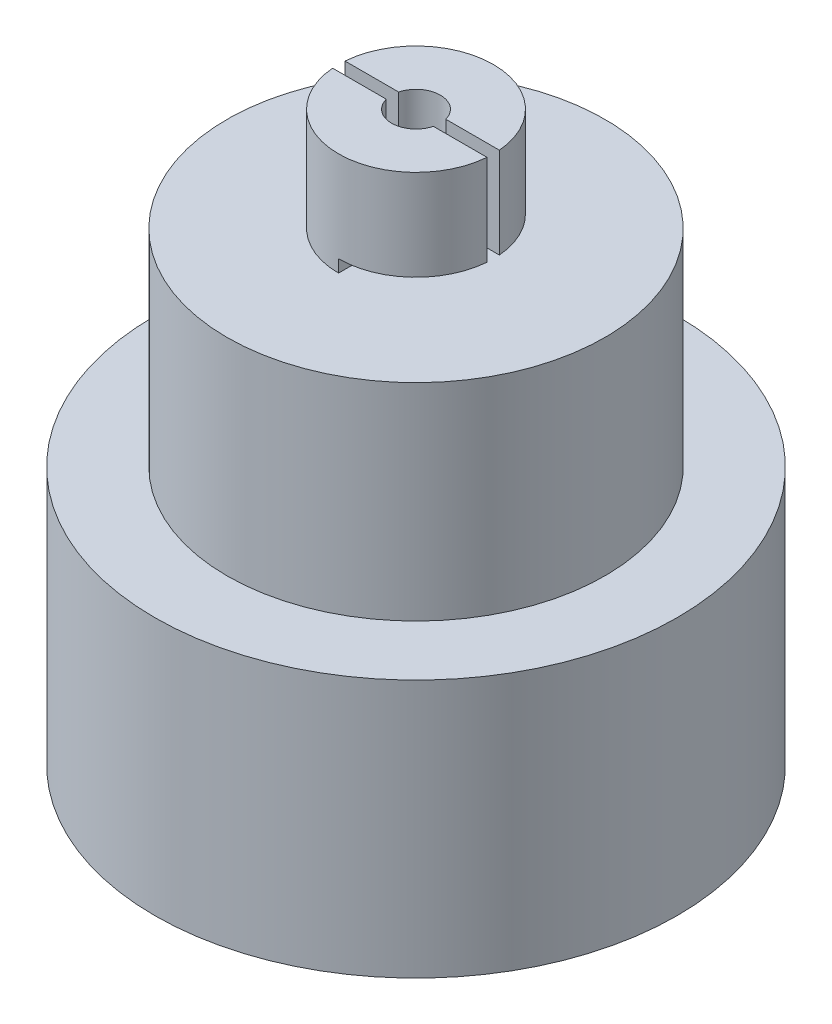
SolidWorks part; units mm, degrees
ref_plane "Front" through (0, 0, 0) normal (0, 0, 1) x (1, 0, 0)
ref_plane "Top" through (0, 0, 0) normal (0, 1, 0) x (1, 0, 0)
ref_plane "Right" through (0, 0, 0) normal (1, 0, 0) x (0, 0, -1)
sketch "Sketch1" plane through (0, 0, 0) normal (0, 1, 0) x (1, 0, 0)
  circle A0 centre (0, 0) radius 16.0655
  dimension "D1" = 32.131
extrude "Base-Extrude" add sketch "Sketch1" along normal blind 15.875
sketch "Sketch2" plane through (0, 15.875, 0) normal (0, 1, 0) x (-1, 0, 0)
  circle A0 centre (0, 0) radius 11.6205
  dimension "D1" = 23.241
extrude "Boss-Extrude1" add sketch "Sketch2" along normal blind 12.7
sketch "Sketch3" plane through (0, 28.575, 0) normal (0, 1, 0) x (-1, 0, 0)
  line L1 (-4.7472, -0.381) -> (4.7472, -0.381)
  line L3 (-4.7472, 0.381) -> (4.7472, 0.381)
  arc A0 (-4.7472, -0.381) -> (4.7472, -0.381) centre (0, 0) ccw
  arc A1 (4.7472, 0.381) -> (-4.7472, 0.381) centre (0, 0) ccw
  dimension "D1" = 9.525
  dimension "D2" = 0.762
  dimension "D3" = 0.381
extrude "Boss-Extrude2" add sketch "Sketch3" along normal blind 6.35
sketch "Sketch4" plane through (0, 34.925, 0) normal (0, 1, 0) x (-1, 0, 0)
  circle A0 centre (0, 0) radius 1.4986
  dimension "D1" = 2.9972
extrude "Cut-Extrude1" cut sketch "Sketch4" against normal blind 6.35
sketch "Sketch5" plane through (0, 0, 0) normal (0, -1, 0) x (1, 0, 0)
  circle A0 centre (0, 0) radius 12.446
  dimension "D1" = 24.892
extrude "Cut-Extrude2" cut sketch "Sketch5" against normal blind 12.7
sketch "Sketch6" plane through (0, 12.7, 0) normal (0, -1, 0) x (1, 0, 0)
  circle A0 centre (0, 0) radius 7.62
  dimension "D1" = 15.24
extrude "Cut-Extrude3" cut sketch "Sketch6" against normal blind 12.7
sketch "Sketch7" plane through (0, 0, 0) normal (1, 0, 0) x (0, 0, -1)
  line L0 (0, -0.9289) -> (0, 32.8574) construction
  line L1 (0, 15.875) -> (0, 0) construction
  line L2 (-7.62, 25.4) -> (7.62, 25.4) construction
  line L3 (0, 25.4) -> (1.8331, 25.4)
  line L4 (0, 22.225) -> (1.8331, 25.4)
  line L5 (-12.446, 0) -> (12.446, 0) construction
  line L6 (0, 25.4) -> (0, 22.225)
  dimension "D1" = 22.225
  dimension "D2" = 60
revolve "Boss-Revolve1" add sketch "Sketch7" angle 360 about L0
sketch "Sketch9" plane through (0, 28.575, 0) normal (0, 1, 0) x (1, 0, 0)
  line L1 (0, 7.4811) -> (8.4518, 7.4811)
  line L2 (0, 7.4811) -> (0, -7.2444)
  line L3 (0, -7.2444) -> (8.4518, -7.2444)
  line L4 (8.4518, 7.4811) -> (8.4518, -7.2444)
extrude "Cut-Extrude6" cut sketch "Sketch9" along normal blind 0.762
